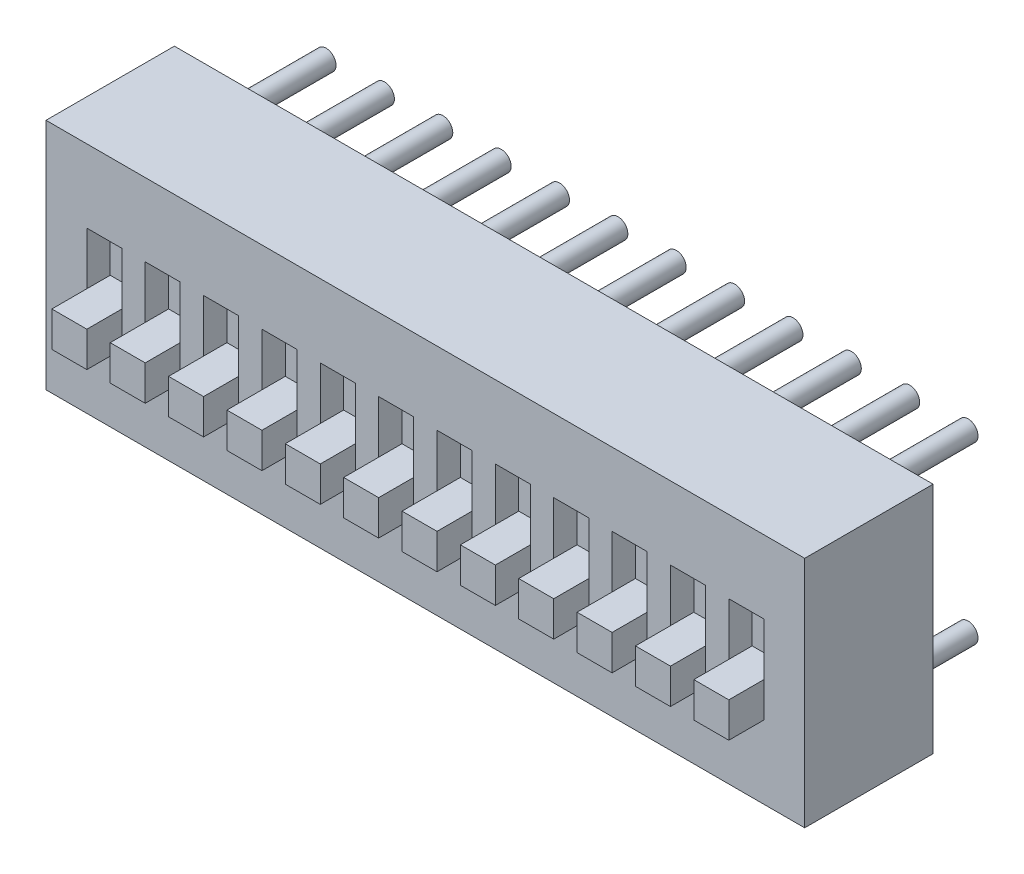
SolidWorks part; units mm, degrees
ref_plane "Front Plane" through (0, 0, 0) normal (0, 0, 1) x (1, 0, 0)
ref_plane "Top Plane" through (0, 0, 0) normal (0, 1, 0) x (1, 0, 0)
ref_plane "Right Plane" through (0, 0, 0) normal (1, 0, 0) x (0, 0, -1)
sketch "Sketch1" plane through (0, 0, 0) normal (0, 0, 1) x (1, 0, 0)
  line L1 (-2.54, -5.08) -> (30.48, -5.08)
  line L2 (-2.54, -5.08) -> (-2.54, 5.08)
  line L3 (-2.54, 5.08) -> (30.48, 5.08)
  line L4 (30.48, -5.08) -> (30.48, 5.08)
extrude "Boss-Extrude1" add sketch "Sketch1" along normal blind 5.588
sketch "Sketch2" plane through (0, 0, 5.588) normal (0, 0, 1) x (1, 0, 0)
  line L1 (-0.762, 1.905) -> (0.762, 1.905)
  line L2 (-0.762, 1.905) -> (-0.762, -1.905)
  line L3 (-0.762, -1.905) -> (0.762, -1.905)
  line L4 (0.762, 1.905) -> (0.762, -1.905)
  line L5 (1.778, 1.905) -> (3.302, 1.905)
  line L6 (1.778, 1.905) -> (1.778, -1.905)
  line L7 (1.778, -1.905) -> (3.302, -1.905)
  line L8 (3.302, 1.905) -> (3.302, -1.905)
  line L9 (4.318, 1.905) -> (5.842, 1.905)
  line L10 (4.318, 1.905) -> (4.318, -1.905)
  line L11 (4.318, -1.905) -> (5.842, -1.905)
  line L12 (5.842, 1.905) -> (5.842, -1.905)
  line L13 (6.858, 1.905) -> (8.382, 1.905)
  line L14 (6.858, 1.905) -> (6.858, -1.905)
  line L15 (6.858, -1.905) -> (8.382, -1.905)
  line L16 (8.382, 1.905) -> (8.382, -1.905)
  line L17 (9.398, 1.905) -> (10.922, 1.905)
  line L18 (9.398, 1.905) -> (9.398, -1.905)
  line L19 (9.398, -1.905) -> (10.922, -1.905)
  line L20 (10.922, 1.905) -> (10.922, -1.905)
  line L21 (11.938, 1.905) -> (13.462, 1.905)
  line L22 (11.938, 1.905) -> (11.938, -1.905)
  line L23 (11.938, -1.905) -> (13.462, -1.905)
  line L24 (13.462, 1.905) -> (13.462, -1.905)
  line L25 (14.478, 1.905) -> (16.002, 1.905)
  line L26 (14.478, 1.905) -> (14.478, -1.905)
  line L27 (14.478, -1.905) -> (16.002, -1.905)
  line L28 (16.002, 1.905) -> (16.002, -1.905)
  line L29 (17.018, 1.905) -> (18.542, 1.905)
  line L30 (17.018, 1.905) -> (17.018, -1.905)
  line L31 (17.018, -1.905) -> (18.542, -1.905)
  line L32 (18.542, 1.905) -> (18.542, -1.905)
  line L33 (19.558, 1.905) -> (21.082, 1.905)
  line L34 (19.558, 1.905) -> (19.558, -1.905)
  line L35 (19.558, -1.905) -> (21.082, -1.905)
  line L36 (21.082, 1.905) -> (21.082, -1.905)
  line L37 (22.098, 1.905) -> (23.622, 1.905)
  line L38 (22.098, 1.905) -> (22.098, -1.905)
  line L39 (22.098, -1.905) -> (23.622, -1.905)
  line L40 (23.622, 1.905) -> (23.622, -1.905)
  line L41 (24.638, 1.905) -> (26.162, 1.905)
  line L42 (24.638, 1.905) -> (24.638, -1.905)
  line L43 (24.638, -1.905) -> (26.162, -1.905)
  line L44 (26.162, 1.905) -> (26.162, -1.905)
  line L45 (27.178, 1.905) -> (28.702, 1.905)
  line L46 (27.178, 1.905) -> (27.178, -1.905)
  line L47 (27.178, -1.905) -> (28.702, -1.905)
  line L48 (28.702, 1.905) -> (28.702, -1.905)
extrude "Cut-Extrude1" cut sketch "Sketch2" against normal blind 1.016
sketch "Sketch3" plane through (0, 0, 4.572) normal (0, 0, 1) x (1, 0, 0)
  line L0 (0.762, -1.905) -> (0.762, 1.905) construction
  line L1 (-0.762, -1.905) -> (0.762, -1.905)
  line L2 (-0.762, -1.905) -> (-0.762, -0.381)
  line L3 (-0.762, -0.381) -> (0.762, -0.381)
  line L4 (0.762, -1.905) -> (0.762, -0.381)
  line L5 (1.778, 1.905) -> (1.778, -1.905) construction
  line L6 (1.778, -0.381) -> (3.302, -0.381)
  line L7 (1.778, -0.381) -> (1.778, -1.905)
  line L8 (1.778, -1.905) -> (3.302, -1.905)
  line L9 (3.302, -0.381) -> (3.302, -1.905)
  line L10 (4.318, 1.905) -> (4.318, -1.905) construction
  line L11 (4.318, -0.381) -> (5.842, -0.381)
  line L12 (4.318, -0.381) -> (4.318, -1.905)
  line L13 (4.318, -1.905) -> (5.842, -1.905)
  line L14 (5.842, -0.381) -> (5.842, -1.905)
  line L15 (6.858, 1.905) -> (6.858, -1.905) construction
  line L16 (6.858, -0.381) -> (8.382, -0.381)
  line L17 (6.858, -0.381) -> (6.858, -1.905)
  line L18 (6.858, -1.905) -> (8.382, -1.905)
  line L19 (8.382, -0.381) -> (8.382, -1.905)
  line L20 (9.398, 1.905) -> (9.398, -1.905) construction
  line L21 (9.398, -0.381) -> (10.922, -0.381)
  line L22 (9.398, -0.381) -> (9.398, -1.905)
  line L23 (9.398, -1.905) -> (10.922, -1.905)
  line L24 (10.922, -0.381) -> (10.922, -1.905)
  line L25 (11.938, 1.905) -> (11.938, -1.905) construction
  line L26 (11.938, -0.381) -> (13.462, -0.381)
  line L27 (11.938, -0.381) -> (11.938, -1.905)
  line L28 (11.938, -1.905) -> (13.462, -1.905)
  line L29 (13.462, -0.381) -> (13.462, -1.905)
  line L30 (14.478, 1.905) -> (14.478, -1.905) construction
  line L31 (14.478, -0.381) -> (16.002, -0.381)
  line L32 (14.478, -0.381) -> (14.478, -1.905)
  line L33 (14.478, -1.905) -> (16.002, -1.905)
  line L34 (16.002, -0.381) -> (16.002, -1.905)
  line L35 (17.018, 1.905) -> (17.018, -1.905) construction
  line L36 (17.018, -0.381) -> (18.542, -0.381)
  line L37 (17.018, -0.381) -> (17.018, -1.905)
  line L38 (17.018, -1.905) -> (18.542, -1.905)
  line L39 (18.542, -0.381) -> (18.542, -1.905)
  line L40 (19.558, 1.905) -> (19.558, -1.905) construction
  line L41 (19.558, -0.381) -> (21.082, -0.381)
  line L42 (19.558, -0.381) -> (19.558, -1.905)
  line L43 (19.558, -1.905) -> (21.082, -1.905)
  line L44 (21.082, -0.381) -> (21.082, -1.905)
  line L45 (22.098, 1.905) -> (22.098, -1.905) construction
  line L46 (22.098, -0.381) -> (23.622, -0.381)
  line L47 (22.098, -0.381) -> (22.098, -1.905)
  line L48 (22.098, -1.905) -> (23.622, -1.905)
  line L49 (23.622, -0.381) -> (23.622, -1.905)
  line L50 (24.638, 1.905) -> (24.638, -1.905) construction
  line L51 (24.638, -0.381) -> (26.162, -0.381)
  line L52 (24.638, -0.381) -> (24.638, -1.905)
  line L53 (24.638, -1.905) -> (26.162, -1.905)
  line L54 (26.162, -0.381) -> (26.162, -1.905)
  line L55 (27.178, 1.905) -> (27.178, -1.905) construction
  line L56 (27.178, -0.381) -> (28.702, -0.381)
  line L57 (27.178, -0.381) -> (27.178, -1.905)
  line L58 (27.178, -1.905) -> (28.702, -1.905)
  line L59 (28.702, -0.381) -> (28.702, -1.905)
extrude "Boss-Extrude2" add sketch "Sketch3" along normal blind 2.54 separate body
sketch "Sketch4" plane through (0, 0, 0) normal (0, 0, -1) x (-1, 0, 0)
  circle A0 centre (0, 3.81) radius 0.4318
  circle A1 centre (0, -3.81) radius 0.4318
  circle A2 centre (-2.54, -3.81) radius 0.4318
  circle A3 centre (-5.08, -3.81) radius 0.4318
  circle A4 centre (-7.62, -3.81) radius 0.4318
  circle A5 centre (-10.16, -3.81) radius 0.4318
  circle A6 centre (-12.7, -3.81) radius 0.4318
  circle A7 centre (-15.24, -3.81) radius 0.4318
  circle A8 centre (-17.78, -3.81) radius 0.4318
  circle A9 centre (-20.32, -3.81) radius 0.4318
  circle A10 centre (-22.86, -3.81) radius 0.4318
  circle A11 centre (-25.4, -3.81) radius 0.4318
  circle A12 centre (-27.94, -3.81) radius 0.4318
  circle A13 centre (-2.54, 3.81) radius 0.4318
  circle A14 centre (-5.08, 3.81) radius 0.4318
  circle A15 centre (-7.62, 3.81) radius 0.4318
  circle A16 centre (-10.16, 3.81) radius 0.4318
  circle A17 centre (-12.7, 3.81) radius 0.4318
  circle A18 centre (-15.24, 3.81) radius 0.4318
  circle A19 centre (-17.78, 3.81) radius 0.4318
  circle A20 centre (-20.32, 3.81) radius 0.4318
  circle A21 centre (-22.86, 3.81) radius 0.4318
  circle A22 centre (-25.4, 3.81) radius 0.4318
  circle A23 centre (-27.94, 3.81) radius 0.4318
extrude "Boss-Extrude3" add sketch "Sketch4" along normal blind 4.064 separate body
